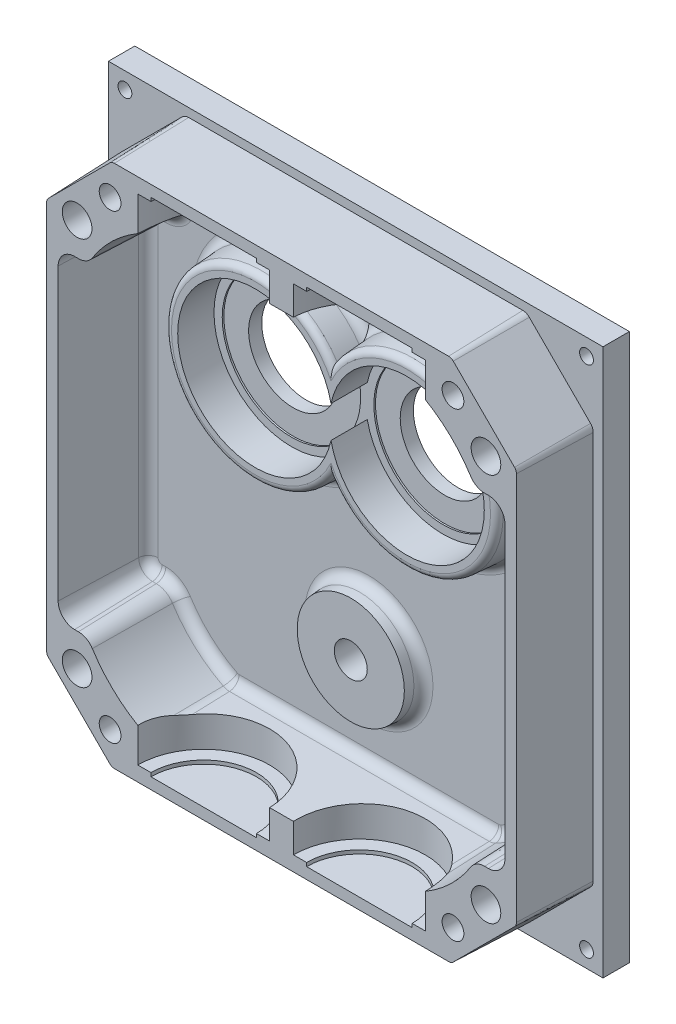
SolidWorks part; units mm, degrees
ref_plane "Plan de face" through (0, 0, 0) normal (0, 0, 1) x (1, 0, 0)
ref_plane "Plan de dessus" through (0, 0, 0) normal (0, 1, 0) x (1, 0, 0)
ref_plane "Plan de droite" through (0, 0, 0) normal (1, 0, 0) x (0, 0, -1)
sketch "Esquisse1" plane through (0, 0, 0) normal (0, 0, 1) x (1, 0, 0)
  line L0 (0, 115.1714) -> (0, -89.6498) construction
  line L1 (-36.7633, 29.4) -> (48.0921, 29.4) construction
  line L2 (-75, 82.9) -> (75, 82.9)
  line L3 (-75, 82.9) -> (-75, -82.9)
  line L4 (-75, -82.9) -> (75, -82.9)
  line L5 (75, 82.9) -> (75, -82.9)
  circle A0 centre (22.994, 29.4) radius 13.5
  circle A1 centre (-22.994, 29.4) radius 13.5
  point P13 (22.994, 29.4)
  dimension "D4" = 27
  dimension "D5" = 22.994
  dimension "D1" = 150
  dimension "D2" = 165.8
  dimension "D3" = 75
  dimension "D6" = 53.5
  dimension "D7" = 82.9
extrude "Extrusion1" add sketch "Esquisse1" along normal blind 4
ref_plane "Plan1" through (0, 0, 30.5) normal (0, 0, -1) x (-1, 0, 0)
sketch "Esquisse2" plane through (0, 0, 30.5) normal (0, 0, -1) x (-1, 0, 0)
  line L0 (52.0858, 78.9142) -> (70.6642, 60.3358)
  line L1 (-50.6716, 79.5) -> (50.6716, 79.5)
  line L2 (-71.25, 58.9216) -> (-71.25, -58.9216)
  line L3 (-50.6716, -79.5) -> (50.6716, -79.5)
  line L4 (71.25, 58.9216) -> (71.25, -58.9216)
  line L5 (-52.0858, 78.9142) -> (-70.6642, 60.3358)
  line L6 (70.6642, -60.3358) -> (52.0858, -78.9142)
  line L7 (-70.6642, -60.3358) -> (-52.0858, -78.9142)
  line L8 (-67.75, 44) -> (-67.75, -44)
  line L9 (67.75, 44) -> (67.75, -44)
  line L10 (-39.3847, 66.2) -> (39.3847, 66.2)
  line L11 (71.25, 59.75) -> (71.25, -59.75) construction
  line L12 (-62.75, 49) -> (-61.5977, 49)
  line L13 (61.5977, -49) -> (62.75, -49)
  line L14 (-67.75, 59.75) -> (-67.75, -59.75) construction
  line L15 (67.75, 59.75) -> (67.75, -59.75) construction
  line L16 (-51.5, 79.5) -> (51.5, 79.5) construction
  line L17 (-51.5, 66.2) -> (51.5, 66.2) construction
  line L18 (0, 0) -> (0, -33.9832) construction
  line L19 (0, 0) -> (34.8408, 0) construction
  line L20 (61.5977, 49) -> (62.75, 49)
  line L21 (-62.75, -49) -> (-61.5977, -49)
  line L22 (-39.3847, -66.2) -> (39.3847, -66.2)
  line L23 (-71.25, 59.75) -> (-71.25, -59.75) construction
  arc A0 (-41.6755, 65.6444) -> (-57.3811, 51.313) centre (-22.994, 29.4) ccw
  arc A1 (41.6755, 65.6444) -> (57.3811, 51.313) centre (22.994, 29.4) cw
  circle A2 centre (-22.994, 29.4) radius 13.5 construction
  arc A3 (41.6755, -65.6444) -> (57.3811, -51.313) centre (22.994, -29.4) ccw
  arc A4 (-41.6755, -65.6444) -> (-57.3811, -51.313) centre (-22.994, -29.4) cw
  arc A5 (67.75, -44) -> (62.75, -49) centre (62.75, -44) cw
  arc A6 (57.3811, -51.313) -> (61.5977, -49) centre (61.5977, -54) cw
  arc A7 (41.6755, -65.6444) -> (39.3847, -66.2) centre (39.3847, -61.2) cw
  arc A8 (-41.6755, -65.6444) -> (-39.3847, -66.2) centre (-39.3847, -61.2) ccw
  arc A9 (-57.3811, -51.313) -> (-61.5977, -49) centre (-61.5977, -54) ccw
  arc A10 (-67.75, -44) -> (-62.75, -49) centre (-62.75, -44) ccw
  arc A11 (-67.75, 44) -> (-62.75, 49) centre (-62.75, 44) cw
  arc A12 (-57.3811, 51.313) -> (-61.5977, 49) centre (-61.5977, 54) cw
  arc A13 (-41.6755, 65.6444) -> (-39.3847, 66.2) centre (-39.3847, 61.2) cw
  arc A14 (41.6755, 65.6444) -> (39.3847, 66.2) centre (39.3847, 61.2) ccw
  arc A15 (57.3811, 51.313) -> (61.5977, 49) centre (61.5977, 54) ccw
  arc A16 (67.75, 44) -> (62.75, 49) centre (62.75, 44) ccw
  arc A17 (71.25, 58.9216) -> (70.6642, 60.3358) centre (69.25, 58.9216) ccw
  arc A18 (52.0858, 78.9142) -> (50.6716, 79.5) centre (50.6716, 77.5) ccw
  arc A19 (-52.0858, 78.9142) -> (-50.6716, 79.5) centre (-50.6716, 77.5) cw
  arc A20 (-71.25, -58.9216) -> (-70.6642, -60.3358) centre (-69.25, -58.9216) ccw
  arc A21 (-52.0858, -78.9142) -> (-50.6716, -79.5) centre (-50.6716, -77.5) ccw
  arc A22 (52.0858, -78.9142) -> (50.6716, -79.5) centre (50.6716, -77.5) cw
  arc A23 (70.6642, -60.3358) -> (71.25, -58.9216) centre (69.25, -58.9216) ccw
  arc A24 (-71.25, 58.9216) -> (-70.6642, 60.3358) centre (-69.25, 58.9216) cw
  point P22 (67.75, -49)
  point P41 (58.75, -49)
  point P44 (40.5556, -66.2)
  point P47 (-40.5556, -66.2)
  point P50 (-58.75, -49)
  point P53 (-67.75, -49)
  point P56 (-67.75, 49)
  point P59 (-58.75, 49)
  point P62 (-40.5556, 66.2)
  point P65 (40.5556, 66.2)
  point P68 (58.75, 49)
  point P71 (67.75, 49)
  point P78 (51.5, 79.5)
  point P87 (-51.5, -79.5)
  point P90 (51.5, -79.5)
  dimension "D18" = 2
  dimension "D14" = 5
  dimension "D15" = 2
  dimension "D20" = 2
  dimension "D2" = 142.5
  dimension "D3" = 71.25
  dimension "D4" = 79.5
  dimension "D5" = 45
  dimension "D6" = 45
  dimension "D7" = 51.5
  dimension "D8" = 79.5
  dimension "D9" = 45
  dimension "D10" = 45
  dimension "D16" = 49
  dimension "D17" = 9
  dimension "D19" = 51.5
  dimension "D21" = 50.6716
  dimension "D11" = 3.5
  dimension "D12" = 3.5
  dimension "D13" = 13.3
extrude "Extrusion2" add sketch "Esquisse2" along normal up to next draft 2
sketch "Esquisse3" plane through (0, 0, 30.5) normal (0, 0, 1) x (1, 0, 0)
  line L0 (23.601, 92.8272) -> (23.601, -91.2633) construction
  line L1 (23.601, 76.1) -> (39.601, 76.1)
  line L2 (39.601, 76.1) -> (39.601, 75)
  line L3 (39.601, 75) -> (43.601, 75)
  line L4 (43.601, 75) -> (43.601, -75)
  line L5 (43.601, -75) -> (39.601, -75)
  line L6 (39.601, -75) -> (39.601, -76.1)
  line L7 (39.601, -76.1) -> (23.601, -76.1)
  line L8 (23.601, 76.1) -> (23.601, -76.1)
  dimension "D1" = 23.601
  dimension "D2" = 40
  dimension "D3" = 150
  dimension "D4" = 152.2
  dimension "D5" = 1.1
  dimension "D6" = 32
  dimension "D7" = 32
  dimension "D8" = 75
revolve "Enlèvement de matière-Révolution1" cut sketch "Esquisse3" angle 360 about L0
mirror "Symétrie1" about plane through (0, 0, 0) normal (1, 0, 0) of "Enlèvement de matière-Révolution1"
ref_plane "Plan2" through (0, 0, 8) normal (0, 0, -1) x (-1, 0, 0)
sketch "Esquisse4" plane through (0, 0, 8) normal (0, 0, -1) x (-1, 0, 0)
  line L4 (75, -82.9) -> (75, 82.9)
  line L5 (-75, -82.9) -> (75, -82.9)
  line L6 (-75, 82.9) -> (-75, -82.9)
  line L7 (75, 82.9) -> (-75, 82.9)
  line L8 (75, -82.9) -> (75, 82.9)
  line L9 (-75, -82.9) -> (75, -82.9)
  line L10 (-75, 82.9) -> (-75, -82.9)
  line L11 (75, 82.9) -> (-75, 82.9)
  line L17 (71.25, -58.9216) -> (71.25, 58.9216)
  line L18 (52.0858, -78.9142) -> (70.6642, -60.3358)
  line L19 (-50.6716, -79.5) -> (50.6716, -79.5)
  line L20 (-70.6642, -60.3358) -> (-52.0858, -78.9142)
  line L21 (-71.25, 58.9216) -> (-71.25, -58.9216)
  line L22 (-52.0858, 78.9142) -> (-70.6642, 60.3358)
  line L23 (50.6716, 79.5) -> (-50.6716, 79.5)
  line L24 (70.6642, 60.3358) -> (52.0858, 78.9142)
  line L25 (71.25, -58.9216) -> (71.25, 58.9216)
  line L26 (52.0858, -78.9142) -> (70.6642, -60.3358)
  line L27 (-50.6716, -79.5) -> (50.6716, -79.5)
  line L28 (-70.6642, -60.3358) -> (-52.0858, -78.9142)
  line L29 (-71.25, 58.9216) -> (-71.25, -58.9216)
  line L30 (-52.0858, 78.9142) -> (-70.6642, 60.3358)
  line L31 (50.6716, 79.5) -> (-50.6716, 79.5)
  line L32 (70.6642, 60.3358) -> (52.0858, 78.9142)
  arc A8 (71.25, 58.9216) -> (70.6642, 60.3358) centre (69.25, 58.9216) ccw
  arc A9 (70.6642, -60.3358) -> (71.25, -58.9216) centre (69.25, -58.9216) ccw
  arc A10 (50.6716, -79.5) -> (52.0858, -78.9142) centre (50.6716, -77.5) ccw
  arc A11 (-52.0858, -78.9142) -> (-50.6716, -79.5) centre (-50.6716, -77.5) ccw
  arc A12 (-71.25, -58.9216) -> (-70.6642, -60.3358) centre (-69.25, -58.9216) ccw
  arc A13 (-70.6642, 60.3358) -> (-71.25, 58.9216) centre (-69.25, 58.9216) ccw
  arc A14 (-50.6716, 79.5) -> (-52.0858, 78.9142) centre (-50.6716, 77.5) ccw
  arc A15 (52.0858, 78.9142) -> (50.6716, 79.5) centre (50.6716, 77.5) ccw
  arc A16 (71.25, 58.9216) -> (70.6642, 60.3358) centre (69.25, 58.9216) ccw
  arc A17 (70.6642, -60.3358) -> (71.25, -58.9216) centre (69.25, -58.9216) ccw
  arc A18 (50.6716, -79.5) -> (52.0858, -78.9142) centre (50.6716, -77.5) ccw
  arc A19 (-52.0858, -78.9142) -> (-50.6716, -79.5) centre (-50.6716, -77.5) ccw
  arc A20 (-71.25, -58.9216) -> (-70.6642, -60.3358) centre (-69.25, -58.9216) ccw
  arc A21 (-70.6642, 60.3358) -> (-71.25, 58.9216) centre (-69.25, 58.9216) ccw
  arc A22 (-50.6716, 79.5) -> (-52.0858, 78.9142) centre (-50.6716, 77.5) ccw
  arc A23 (52.0858, 78.9142) -> (50.6716, 79.5) centre (50.6716, 77.5) ccw
  dimension "D1" = 0
  dimension "D2" = 0
extrude "Extrusion3" add sketch "Esquisse4" along normal up to next
ref_plane "Plan3" through (0, 0, 15.5) normal (0, 0, 1) x (1, 0, 0)
sketch "Esquisse5" plane through (0, 0, 15.5) normal (0, 0, 1) x (1, 0, 0)
  arc A2 (0, 44.0232) -> (0, 14.7768) centre (-22.994, 29.4) ccw
  arc A3 (0, 14.7768) -> (0, 44.0232) centre (22.994, 29.4) ccw
  dimension "D3" = 54.5
  dimension "D4" = 54.5
extrude "Extrusion4" add sketch "Esquisse5" against normal up to surface (11.5 mm away) draft 4
fillet "Congé1" radius 2 2 edges at (-50.244, 29.4, 15.5) (50.244, 29.4, 15.5)
sketch "Esquisse6" plane through (0, 0, 15.5) normal (0, 0, 1) x (1, 0, 0)
  point P0 (22.994, 29.4)
ref_plane "Plan4" through (22.994, 0, 0) normal (-1, 0, 0) x (0, 0, 1)
sketch "Esquisse7" plane through (22.994, 0, 0) normal (-1, 0, 0) x (0, 0, 1)
  line L0 (4, 29.4) -> (4, 50.4)
  line L1 (4, 50.4) -> (4.5, 50.4)
  line L2 (4.5, 50.4) -> (4.5, 52.9)
  line L3 (4.5, 52.9) -> (15.5, 52.9)
  line L4 (15.5, 52.9) -> (15.5, 29.4)
  line L5 (15.5, 29.4) -> (4, 29.4)
  line L6 (15.5, 4.015) -> (15.5, 54.785) construction
  line L7 (30.5, 29.4) -> (4, 29.4) construction
  dimension "D1" = 23.5
  dimension "D2" = 11
  dimension "D3" = 11.5
  dimension "D4" = 21
revolve "Enlèvement de matière-Révolution2" cut sketch "Esquisse7" angle 360 about axis through (22.994, 29.4, 4) along (0, 0, -1)
mirror "Symétrie2" about plane through (0, 0, 0) normal (1, 0, 0) of "Enlèvement de matière-Révolution2"
ref_plane "Plan5" through (0, 0, 9.5) normal (0, 0, 1) x (1, 0, 0)
sketch "Esquisse8" plane through (0, 0, 9.5) normal (0, 0, 1) x (1, 0, 0)
  line L0 (50.6716, -79.5) -> (-50.6716, -79.5) construction
  circle A0 centre (0, -36.1) radius 16.25
  dimension "D2" = 32.5
  dimension "D1" = 43.4
extrude "Extrusion5" add sketch "Esquisse8" against normal up to surface (5.5 mm away) draft 4
sketch "Esquisse9" plane through (0, 0, 9.5) normal (0, 0, 1) x (1, 0, 0)
  circle A0 centre (0, -36.1) radius 5
  dimension "D1" = 10
extrude "Enlèv. mat.-Extru.1" cut sketch "Esquisse9" against normal blind 7.5
fillet "Congé2" radius 3 27 edges at (-66.8246, 0, 4) (-65.6312, 46.8812, 4) (-62.1739, 48.0746, 4) (-58.748, 48.8049, 4) (-49.8551, 58.8368, 4) (-40.3452, 65.1598, 4) (0, 65.2746, 4) (40.3452, 65.1598, 4) (49.8551, 58.8368, 4) (58.748, 48.8049, 4) (62.1739, 48.0746, 4) (65.6312, 46.8812, 4) (66.8246, 0, 4) (65.6312, -46.8812, 4) (62.1739, -48.0746, 4) (58.748, -48.8049, 4) (49.8551, -58.8368, 4) (40.3452, -65.1598, 4) (0, -65.2746, 4) (-40.3452, -65.1598, 4) (-49.8551, -58.8368, 4) (-58.748, -48.8049, 4) (-62.1739, -48.0746, 4) (-65.6312, -46.8812, 4) (-51.0482, 29.4, 4) (51.0482, 29.4, 4) (16.6346, -36.1, 4)
hole_wizard "Trou taraudé M5x0.81" positions "Esquisse3D1" profile "Esquisse10" tap size "M5x0.8" standard "ISO"
sketch3d "Esquisse3D1"
  line L2 (-75, 82.9, 8) -> (75, 82.9, 8) construction
  line L3 (75, 82.9, 8) -> (75, -82.9, 8) construction
  line L4 (-75, -82.9, 8) -> (-75, 82.9, 8) construction
  line L5 (75, -82.9, 8) -> (-75, -82.9, 8) construction
  point P24 (-70, 77.9, 8)
  point P29 (-70, -77.9, 8)
  point P31 (70, -77.9, 8)
  point P38 (70, 77.9, 8)
  dimension "D1" = 5
  dimension "D2" = 5
  dimension "D3" = 5
  dimension "D4" = 5
  dimension "D5" = 5
  dimension "D6" = 5
  dimension "D7" = 5
  dimension "D8" = 5
sketch "Esquisse10" plane through (-70, 77.9, 8) normal (1, 0, 0) x (0, -1, 0)
  line L0 (0, 0) -> (0, 8)
  line L1 (0, 8) -> (2.1, 8)
  line L2 (2.1, 8) -> (2.1, 0)
  line L5 (2.1, 0) -> (0, 0)
  line L11 (0, -6.35) -> (0, 107.95) construction
  dimension "Diamètre du trou pour taraudage jusqu'au prochain" = 4.2
  dimension "Profondeur du trou pour taraudage jusqu'au prochain" = 8
hole_wizard "Chambrage pour vis à tête hexagonale M61" positions "Esquisse3D2" profile "Esquisse11" counterbore size "M6" standard "ISO"
sketch3d "Esquisse3D2"
  line L0 (75, 82.9, 0) -> (-75, 82.9, 0) construction
  line L1 (75, -82.9, 0) -> (75, 82.9, 0) construction
  line L2 (-75, -82.9, 0) -> (75, -82.9, 0) construction
  point P0 (52, 69.9, 0)
  point P7 (52, -69.9, 0)
  dimension "D1" = 13
  dimension "D2" = 23
  dimension "D3" = 13
sketch "Esquisse11" plane through (52, 69.9, 0) normal (1, 0, 0) x (0, 1, 0)
  line L0 (0, 0) -> (0, 30.5)
  line L1 (0, 30.5) -> (3.3, 30.5)
  line L3 (3.3, 30.5) -> (3.3, 6)
  line L4 (3.3, 6) -> (5.5, 6)
  line L5 (5.5, 6) -> (5.5, 0)
  line L7 (5.5, 0) -> (0, 0)
  line L11 (0, -6.35) -> (0, 107.95) construction
  dimension "Diamètre du perçage jusqu'au prochain" = 6.6
  dimension "Profondeur du perçage jusqu'au prochain" = 30.5
  dimension "Diamètre du chambrage" = 11
  dimension "Profondeur du chambrage" = 6
mirror "Symétrie3" about plane through (0, 0, 0) normal (1, 0, 0) of "Chambrage pour vis à tête hexagonale M61"
sketch "Esquisse12" plane through (0, 0, 30.5) normal (0, 0, 1) x (1, 0, 0)
  line L0 (-75, 82.9) -> (75, 82.9) construction
  line L1 (75, 82.9) -> (75, -82.9) construction
  line L2 (75, -82.9) -> (-75, -82.9) construction
  line L3 (0, 0) -> (0, 78.1429) construction
  circle A0 centre (62, 58.9) radius 4.5
  circle A1 centre (62, -58.9) radius 4.5
  circle A2 centre (-62, -58.9) radius 4.5
  circle A3 centre (-62, 58.9) radius 4.5
  dimension "D1" = 9
  dimension "D3" = 13
  dimension "D4" = 9
  dimension "D2" = 24
  dimension "D5" = 24
extrude "Enlèv. mat.-Extru.2" cut sketch "Esquisse12" against normal through all
